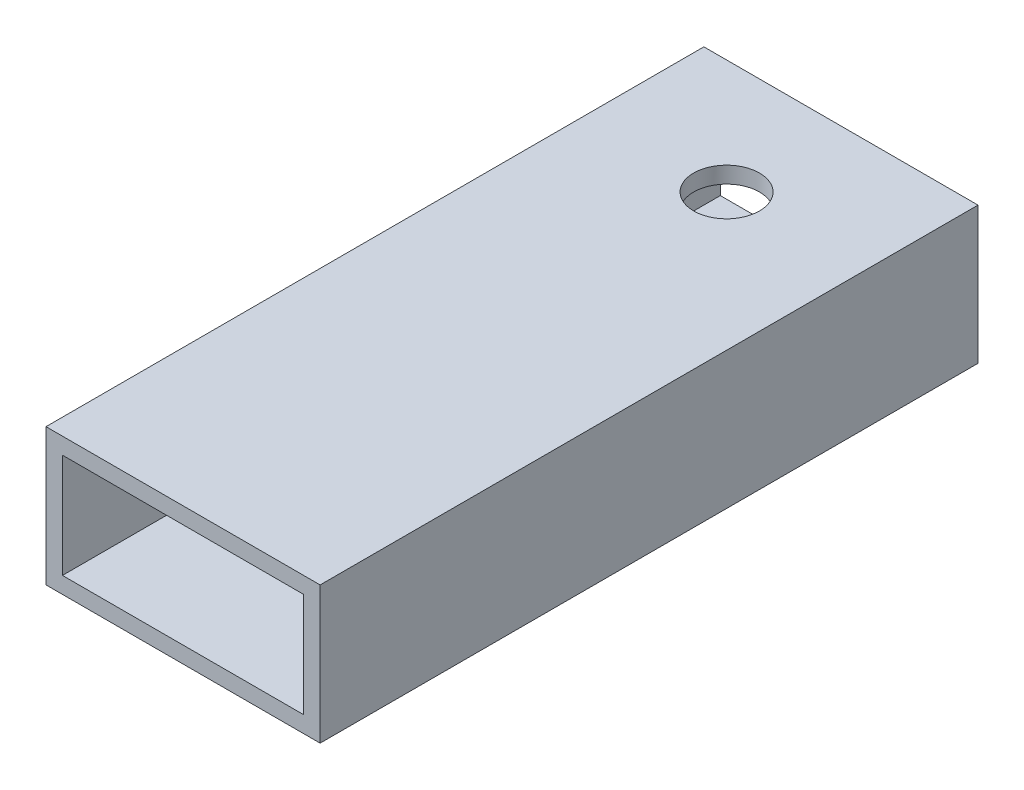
SolidWorks part; units mm, degrees
ref_plane "Plan de face" through (0, 0, 0) normal (0, 0, 1) x (1, 0, 0)
ref_plane "Plan de dessus" through (0, 0, 0) normal (0, 1, 0) x (1, 0, 0)
ref_plane "Plan de droite" through (0, 0, 0) normal (1, 0, 0) x (0, 0, -1)
sketch "Esquisse1" plane through (0, 0, 0) normal (0, 0, 1) x (1, 0, 0)
  line L1 (0, 0) -> (50, 0)
  line L2 (0, 0) -> (0, 25)
  line L3 (0, 25) -> (50, 25)
  line L4 (50, 0) -> (50, 25)
  line L5 (3, 22) -> (47, 22)
  line L6 (3, 22) -> (3, 3)
  line L7 (3, 3) -> (47, 3)
  line L8 (47, 22) -> (47, 3)
  dimension "D1" = 50
  dimension "D2" = 25
  dimension "D3" = 3
  dimension "D4" = 3
  dimension "D5" = 3
  dimension "D6" = 3
extrude "Extrusion1" add sketch "Esquisse1" along normal blind 120
sketch "Esquisse2" plane through (0, 25, 0) normal (0, 1, 0) x (-1, 0, 0)
  line L0 (-50, 120) -> (-50, 0) construction
  circle A0 centre (-25, 20.8609) radius 6
  dimension "D1" = 12
  dimension "D2" = 25
extrude "Enlèv. mat.-Extru.1" cut sketch "Esquisse2" against normal through all
